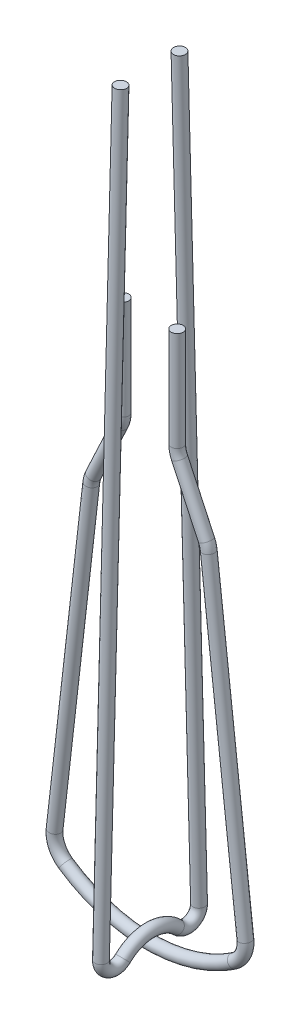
SolidWorks part; units mm, degrees
ref_plane "Front Plane" through (0, 0, 0) normal (0, 0, 1) x (1, 0, 0)
ref_plane "Top Plane" through (0, 0, 0) normal (0, 1, 0) x (1, 0, 0)
ref_plane "Right Plane" through (0, 0, 0) normal (1, 0, 0) x (0, 0, -1)
sketch "Sketch1" plane through (0, 0, 0) normal (0, 0, 1) x (1, 0, 0)
  line L0 (-6.6675, 19.2996) -> (-6.6675, -5.1111)
  line L2 (-7.2624, -7.7947) -> (-13.8521, -21.9263)
  line L3 (-14.4054, -23.8834) -> (-23.3995, -101.9808)
  line L4 (0, 0) -> (0, -139.0825) construction
  line L5 (14.4054, -23.8834) -> (23.3995, -101.9808)
  line L6 (7.2624, -7.7947) -> (13.8521, -21.9263)
  line L7 (6.6675, 19.2996) -> (6.6675, -5.1111)
  arc A0 (-20.6519, -107.965) -> (20.6519, -107.965) centre (0, -77.47) ccw
  arc A1 (-23.3995, -101.9808) -> (-20.6519, -107.965) centre (-17.0912, -102.7073) ccw
  arc A2 (23.3995, -101.9808) -> (20.6519, -107.965) centre (17.0912, -102.7073) cw
  arc A3 (14.4054, -23.8834) -> (13.8521, -21.9263) centre (8.0971, -24.6099) ccw
  arc A4 (7.2624, -7.7947) -> (6.6675, -5.1111) centre (13.0175, -5.1111) cw
  arc A5 (-13.8521, -21.9263) -> (-14.4054, -23.8834) centre (-8.0971, -24.6099) ccw
  arc A6 (-6.6675, -5.1111) -> (-7.2624, -7.7947) centre (-13.0175, -5.1111) cw
  point P16 (-23.8125, -105.5665)
  point P19 (23.8125, -105.5665)
  point P22 (14.2875, -22.86)
  point P25 (6.6675, -6.5189)
  point P28 (-14.2875, -22.86)
  point P31 (-6.6675, -6.5189)
  dimension "D4" = 91.44
  dimension "D5" = 36.83
  dimension "D7" = 6.35
  dimension "D1" = 114.3
  dimension "D2" = 28.575
  dimension "D3" = 47.625
  dimension "D6" = 25
  dimension "D8" = 13.335
  dimension "D9" = 19.2996
ref_plane "Plane1" through (-6.6675, 19.2996, 0) normal (0, -1, 0) x (1, 0, 0)
sketch "Sketch3" plane through (-6.6675, 19.2996, 0) normal (0, -1, 0) x (1, 0, 0)
  circle A0 centre (0, 0) radius 1.4605
  dimension "D1" = 2.921
sweep "Sweep1" add profiles "Sketch3" path "Sketch1"
sketch "Sketch5" plane through (0, 0, 0) normal (1, 0, 0) x (0, 0, -1)
  line L3 (7.2298, 71.374) -> (12.0343, -112.1034)
  line L8 (0, 0) -> (0, 155.0141) construction
  line L10 (-7.2298, 71.374) -> (-12.0343, -112.1034)
  arc A0 (12.0343, -112.1034) -> (6.6453, -114.4611) centre (8.8604, -112.1865) cw
  arc A1 (-12.0343, -112.1034) -> (-6.6453, -114.4611) centre (-8.8604, -112.1865) ccw
  arc A2 (6.6453, -114.4611) -> (-6.6453, -114.4611) centre (0, -121.285) ccw
  dimension "D1" = 3.175
  dimension "D5" = 9.525
  dimension "D2" = 14.4596
  dimension "D3" = 111.76
  dimension "D4" = 3
  dimension "D6" = 71.374
ref_plane "Plane2" through (0, 71.374, 7.2298) normal (0, -0.9997, 0.0262) x (1, 0, 0)
sketch "Sketch6" plane through (0, 71.374, 7.2298) normal (0, -0.9997, 0.0262) x (1, 0, 0)
  circle A0 centre (0, 0) radius 1.4605
  dimension "D1" = 2.921
sweep "Sweep2" add profiles "Sketch6" path "Sketch5"
